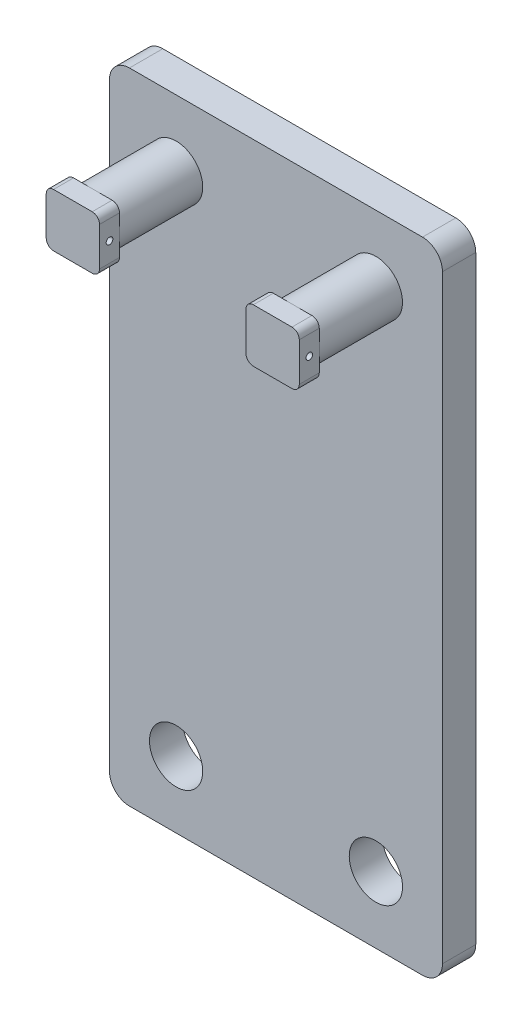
SolidWorks part; units mm, degrees
ref_plane "Front Plane" through (0, 0, 0) normal (0, 0, 1) x (1, 0, 0)
ref_plane "Top Plane" through (0, 0, 0) normal (0, 1, 0) x (1, 0, 0)
ref_plane "Right Plane" through (0, 0, 0) normal (1, 0, 0) x (0, 0, -1)
sketch "Sketch1" plane through (0, 0, 0) normal (0, 0, 1) x (1, 0, 0)
  line L0 (0, 55.3116) -> (0, -904.6884) construction
  line L1 (250, 55.3116) -> (-250, 55.3116)
  line L2 (-250, 55.3116) -> (-250, -44.6884)
  line L3 (-250, -904.6884) -> (250, -904.6884)
  line L4 (0, -424.6884) -> (-250, -424.6884) construction
  line L5 (250, -804.6884) -> (250, -904.6884)
  line L9 (-250, -264.6884) -> (-250, -584.6884)
  line L13 (-250, -804.6884) -> (-250, -904.6884)
  line L17 (250, -264.6884) -> (250, -584.6884)
  line L21 (250, 55.3116) -> (250, -44.6884)
  line L22 (-250, -44.6884) -> (-250, -264.6884)
  line L23 (-250, -584.6884) -> (-250, -804.6884)
  line L24 (250, -44.6884) -> (250, -264.6884)
  line L25 (250, -584.6884) -> (250, -804.6884)
extrude "Boss-Extrude1" add sketch "Sketch1" along normal blind 50
fillet "Fillet1" radius 30 1 edges at (-250, 55.3116, 25)
fillet "Fillet2" radius 30 1 edges at (250, 55.3116, 25)
fillet "Fillet3" radius 30 1 edges at (-250, -904.6884, 25)
fillet "Fillet4" radius 30 1 edges at (250, -904.6884, 25)
sketch "Sketch6" plane through (0, 0, 50) normal (0, 0, 1) x (1, 0, 0)
  line L0 (0, 55.3116) -> (0, -804.6884) construction
  line L1 (220, 55.3116) -> (-220, 55.3116) construction
  line L3 (250, -424.6884) -> (-250, -424.6884) construction
  line L4 (250, -874.6884) -> (250, 25.3116) construction
  line L5 (-250, 25.3116) -> (-250, -874.6884) construction
  circle A0 centre (-150, -804.6884) radius 40
  circle A1 centre (150, -804.6884) radius 40
extrude "Cut-Extrude3" cut sketch "Sketch6" against normal blind 75
sketch "Sketch7" plane through (0, 0, 50) normal (0, 0, 1) x (1, 0, 0)
  line L0 (-250, -424.6884) -> (250, -424.6884) construction
  line L1 (-250, 25.3116) -> (-250, -874.6884) construction
  line L2 (250, -874.6884) -> (250, 25.3116) construction
  circle A2 centre (150, -44.6884) radius 40
  circle A3 centre (-150, -44.6884) radius 40
extrude "Boss-Extrude4" add sketch "Sketch7" along normal blind 125
sketch "Sketch8" plane through (0, 0, 175) normal (0, 0, 1) x (1, 0, 0)
  line L1 (-190, -4.6884) -> (-110, -4.6884)
  line L2 (-190, -4.6884) -> (-190, -84.6884)
  line L3 (-190, -84.6884) -> (-110, -84.6884)
  line L4 (-110, -4.6884) -> (-110, -84.6884)
  line L5 (-190, -4.6884) -> (-110, -84.6884) construction
  line L6 (-190, -84.6884) -> (-110, -4.6884) construction
  point P0 (-150, -44.6884)
extrude "Boss-Extrude5" add sketch "Sketch8" along normal blind 30
sketch "Sketch9" plane through (-190, 0, 0) normal (-1, 0, 0) x (0, 0, 1)
  line L0 (205, -44.6884) -> (175, -44.6884) construction
  line L1 (205, -4.6884) -> (205, -84.6884) construction
  circle A0 centre (190, -44.6884) radius 5
extrude "Cut-Extrude4" cut sketch "Sketch9" against normal blind 80
mirror "Mirror2" about plane through (0, 0, 0) normal (1, 0, 0) of "Cut-Extrude4", "Boss-Extrude5"
fillet "Fillet13" radius 11 1 edges at (-190, -4.6884, 190)
fillet "Fillet14" radius 11 1 edges at (-110, -4.6884, 190)
fillet "Fillet15" radius 11 1 edges at (-110, -84.6884, 190)
fillet "Fillet16" radius 11 1 edges at (-190, -84.6884, 190)
fillet "Fillet17" radius 11 1 edges at (110, -4.6884, 190)
fillet "Fillet18" radius 11 1 edges at (110, -84.6884, 190)
fillet "Fillet19" radius 11 1 edges at (190, -84.6884, 190)
fillet "Fillet20" radius 11 1 edges at (190, -4.6884, 190)
